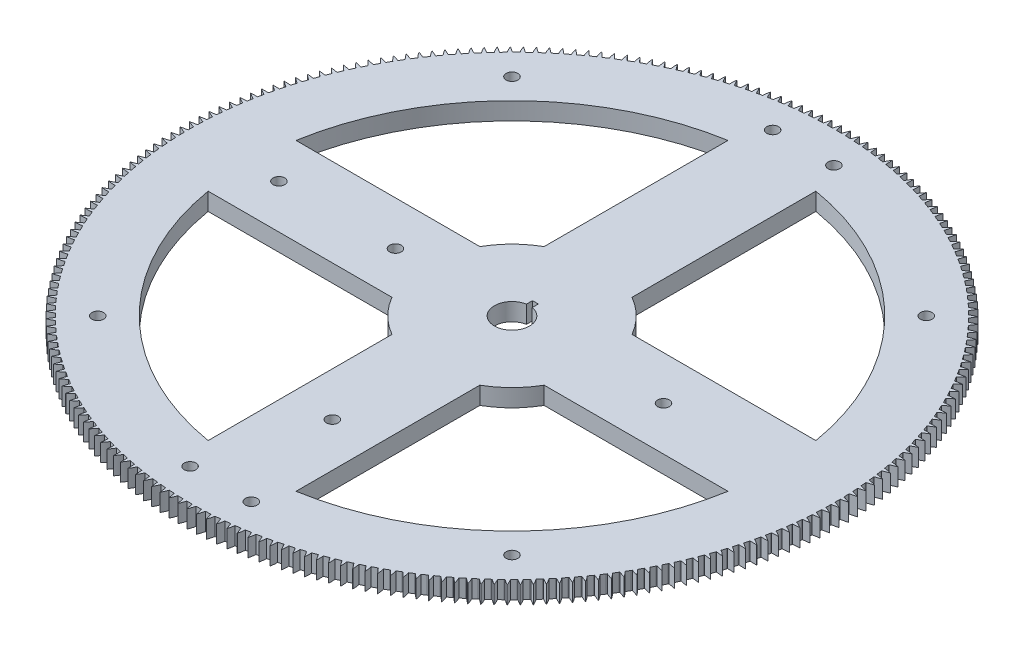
SolidWorks part; units mm, degrees
ref_plane "Front Plane" through (0, 0, 0) normal (0, 0, 1) x (1, 0, 0)
ref_plane "Top Plane" through (0, 0, 0) normal (0, 1, 0) x (1, 0, 0)
ref_plane "Right Plane" through (0, 0, 0) normal (1, 0, 0) x (0, 0, -1)
sketch "Sketch1" plane through (0, 0, 0) normal (0, 1, 0) x (1, 0, 0)
  line L0 (0, 0) -> (0, 53.9742) construction
  line L1 (0, 0) -> (-53.9742, 0) construction
  line L2 (0, 0) -> (-56.2486, -0.3962) construction
  line L3 (0, 0) -> (-53.9689, -0.7604) construction
  line L4 (0, 0) -> (-53.9528, -1.5206) construction
  circle A0 centre (0, 0) radius 55.75 construction
  circle A1 centre (0, 0) radius 53.9742 construction
  circle A2 centre (0, 0) radius 55.125 construction
  circle A3 centre (0, 0) radius 56.25 construction
  spline S0 degree 4 poles (-53.9742, 0) (-54.0235, 0) (-54.1219, -0.0023) (-54.3976, -0.0205) (-54.9164, -0.0854) (-55.7069, -0.2377) (-56.7591, -0.5226) (-58.0929, -0.9847) (-59.6238, -1.6441) (-61.2555, -2.4881) (-62.9679, -3.5289) (-64.6144, -4.674) (-66.194, -5.9096) (-67.7073, -7.2254) (-69.4639, -8.9091) (-71.4602, -11.0612) (-73.6203, -13.7358) (-75.8559, -16.9794) (-77.8889, -20.4383) (-79.6835, -24.0266) (-81.0503, -27.2594) (-82.0803, -30.0856) (-82.8461, -32.4712) (-83.4039, -34.3977) (-83.9076, -36.3363) (-84.3581, -38.293) (-84.7557, -40.2525) (-85.1017, -42.236) (-85.3959, -44.2044) (-85.6406, -46.2185) (-85.8338, -48.1714) (-85.9626, -49.9919) (-86.0385, -51.3811) (-86.0868, -52.7653) (-86.1051, -53.4887) (-86.1211, -54.4894) (-86.1238, -55.2624) (-86.1208, -56.1276) (-86.1084, -56.94) (-86.0889, -57.7851) (-86.0609, -58.6072) (-86.0344, -59.2385) (-86.0139, -59.6496) (-86.0031, -59.8592) knots 0 0 0 0 0 0.002688 0.005377 0.015084 0.028532 0.04661 0.064855 0.092111 0.119476 0.146842 0.174209 0.201575 0.228941 0.256307 0.307035 0.361767 0.4165 0.471232 0.525964 0.580697 0.608063 0.635429 0.662795 0.690161 0.717528 0.744894 0.77226 0.799626 0.826992 0.854358 0.881725 0.895408 0.909091 0.920455 0.931818 0.943182 0.954545 0.965909 0.977273 0.988636 1 1 1 1 1 construction
  spline S1 degree 4 poles (-53.9742, 0) (-54.0235, 0) (-54.1219, -0.0023) (-54.3976, -0.0205) (-54.9164, -0.0854) (-55.7069, -0.2377) (-56.7591, -0.5226) (-58.0929, -0.9847) (-59.6238, -1.6441) (-61.2555, -2.4881) (-62.9679, -3.5289) (-64.6144, -4.674) (-66.194, -5.9096) (-67.7073, -7.2254) (-69.4639, -8.9091) (-71.4602, -11.0612) (-73.6203, -13.7358) (-75.8559, -16.9794) (-77.8889, -20.4383) (-79.6835, -24.0266) (-81.0503, -27.2594) (-82.0803, -30.0856) (-82.8461, -32.4712) (-83.4039, -34.3977) (-83.9076, -36.3363) (-84.3581, -38.293) (-84.7557, -40.2525) (-85.1017, -42.236) (-85.3959, -44.2044) (-85.6406, -46.2185) (-85.8338, -48.1714) (-85.9626, -49.9919) (-86.0385, -51.3811) (-86.0785, -52.5273) (-86.0914, -52.9747) (-86.097, -53.2024) knots 0 0 0 0 0 0.002688 0.005377 0.015084 0.028532 0.04661 0.064855 0.092111 0.119476 0.146842 0.174209 0.201575 0.228941 0.256307 0.307035 0.361767 0.4165 0.471232 0.525964 0.580697 0.608063 0.635429 0.662795 0.690161 0.717528 0.744894 0.77226 0.799626 0.826992 0.854358 0.881725 0.895408 0.909091 0.909091 0.909091 0.909091 0.909091
  dimension "D1" = 112.5
  dimension "D2" = 111.5
  dimension "D3" = 107.9485
  dimension "D4" = 110.25
  dimension "D5" = 53.9742
  dimension "D6" = 0.404
  dimension "D7" = 0.807
  dimension "D8" = 1.614
sketch "Sketch2" plane through (0, 0, 0) normal (0, 1, 0) x (1, 0, 0)
  line L0 (0, 0) -> (-56.2486, -0.3962) construction
  line L1 (0, 0) -> (-56.2486, -0.3962) construction
  line L2 (0, 0) -> (-53.9689, -0.7604) construction
  line L3 (0, 0) -> (-53.9742, 0) construction
  line L4 (0, 0) -> (-53.9528, -1.5206) construction
  line L5 (0, 0) -> (-53.9689, -0.7604) construction
  line L6 (0, 0) -> (-53.9742, 0) construction
  line L7 (0, 0) -> (-53.9528, -1.5206) construction
  line L8 (-55.125, 0) -> (-55.1195, -0.7766) construction
  line L9 (-55.1195, -0.7766) -> (-55.1031, -1.553)
  line L10 (-55.1031, -1.553) -> (-53.9528, -1.5206) construction
  line L11 (-55.1031, -1.553) -> (-2.9988, -0.0845)
  line L12 (-53.9742, 0) -> (-3, 0)
  line L13 (-53.9742, 0) -> (-55.125, 0)
  line L14 (-55.125, 0) -> (-55.1241, -0.1312)
  circle A0 centre (0, 0) radius 55.125 construction
  circle A1 centre (0, 0) radius 53.9742 construction
  circle A2 centre (0, 0) radius 55.75 construction
  circle A3 centre (0, 0) radius 56.25 construction
  circle A4 centre (0, 0) radius 55.125 construction
  circle A5 centre (0, 0) radius 53.9742 construction
  circle A6 centre (0, 0) radius 55.75 construction
  circle A7 centre (0, 0) radius 56.25 construction
  arc A8 (-56.2486, -0.4004) -> (-56.2486, -0.392) centre (0, 0) cw
  circle A11 centre (0, 0) radius 3 construction
  arc A12 (-3, 0) -> (-2.9988, -0.0845) centre (-0.0002, 0) ccw
  spline S0 degree 4 poles (7.0666, 1998.4473) (-46.4874, -61.228) (-48.3447, -1.3043) (-51.6015, 0.3295) (-54.9164, -0.0854) (-55.7069, -0.2377) (-56.7591, -0.5226) (-58.0929, -0.9847) (-59.6238, -1.6441) (-61.2555, -2.4881) (-62.9679, -3.5289) (-64.6144, -4.674) (-66.194, -5.9096) (-67.7073, -7.2254) (-69.4639, -8.9091) (-71.4602, -11.0612) (-73.6203, -13.7358) (-75.8559, -16.9794) (-77.8889, -20.4383) (-79.6835, -24.0266) (-81.0503, -27.2594) (-82.0803, -30.0856) (-82.8461, -32.4712) (-83.4039, -34.3977) (-83.9076, -36.3363) (-84.3581, -38.293) (-84.7557, -40.2525) (-85.1017, -42.236) (-85.3959, -44.2044) (-85.6406, -46.2185) (-85.8338, -48.1714) (-85.9626, -49.9919) (-86.2032, -54.3966) (-86.2268, -62.3247) (-84.2314, 4.188) (-134.1673, -2052.2405) knots -0.153792 -0.153792 -0.153792 -0.153792 -0.153792 0.002688 0.005377 0.015084 0.028532 0.04661 0.064855 0.092111 0.119476 0.146842 0.174209 0.201575 0.228941 0.256307 0.307035 0.361767 0.4165 0.471232 0.525964 0.580697 0.608063 0.635429 0.662795 0.690161 0.717528 0.744894 0.77226 0.799626 0.826992 0.854358 0.881725 0.895408 1.087301 1.087301 1.087301 1.087301 1.087301 only from (-53.9742, 0) to (-86.097, -53.2024) construction
  spline S1 degree 4 poles (-55.1241, -0.1312) (-55.353, -0.1735) (-55.6354, -0.2338) (-55.916, -0.302) (-56.1947, -0.3772) (-56.2486, -0.392) knots 0.015819 0.015819 0.015819 0.015819 0.015819 0.028532 0.031584 0.031584 0.031584 0.031584 0.031584
  spline S2 degree 4 poles (-55.1195, -0.7766) (-55.1271, -0.7751) (-55.2126, -0.7585) (-55.4041, -0.712) (-55.6895, -0.6254) (-55.9614, -0.523) (-56.156, -0.4412) (-56.2486, -0.4004) knots 0.004428 0.004428 0.004428 0.004428 0.004428 0.005377 0.015084 0.028532 0.040915 0.040915 0.040915 0.040915 0.040915
  point P18 (-55.1223, -0.3883)
  point P24 (-55.1031, -1.553)
  dimension "D2" = 6
extrude "Boss-Extrude1" add sketch "Sketch2" along normal blind 3
pattern_circular "CirPattern1" count 223 over 360 of "Boss-Extrude1"
sketch "Sketch3" plane through (0, 3, 0) normal (0, 1, 0) x (1, 0, 0)
  line L1 (0.5, 1.9998) -> (-0.5, 1.9998)
  line L2 (0.5, 1.9998) -> (0.5, 3.9998)
  line L3 (0.5, 3.9998) -> (-0.5, 3.9998)
  line L4 (-0.5, 1.9998) -> (-0.5, 3.9998)
  line L5 (0.5, 1.9998) -> (-0.5, 3.9998) construction
  line L6 (0.5, 3.9998) -> (-0.5, 1.9998) construction
  circle A0 centre (-0.0001, -0.0001) radius 2.9999 construction
  point P0 (0, 2.9998)
  dimension "D1" = 2
  dimension "D2" = 1
extrude "Cut-Extrude1" cut sketch "Sketch3" against normal up to surface (3 mm away)
sketch "Sketch4" plane through (0, 3, 0) normal (0, 1, 0) x (1, 0, 0)
  line L0 (-44.3707, 7.5) -> (-12.9905, 7.5)
  line L1 (-44.3707, -7.5) -> (-12.9905, -7.5)
  line L2 (-7.5002, -44.3706) -> (-7.5002, -12.9904)
  line L3 (7.4998, -44.3706) -> (7.4998, -12.9904)
  line L4 (44.3704, -7.5) -> (12.9902, -7.5)
  line L5 (44.3704, 7.5) -> (12.9902, 7.5)
  line L6 (7.4998, 44.3706) -> (7.4998, 12.9904)
  line L7 (-7.5002, 44.3706) -> (-7.5002, 12.9904)
  arc A0 (-12.9905, -7.5) -> (-7.5002, -12.9904) centre (-0.0002, 0) ccw
  arc A1 (-44.3707, -7.5) -> (-7.5002, -44.3706) centre (-0.0002, 0) ccw
  arc A2 (7.4998, -44.3706) -> (44.3704, -7.5) centre (-0.0002, 0) ccw
  arc A3 (7.4998, -12.9904) -> (12.9902, -7.5) centre (-0.0002, 0) ccw
  arc A4 (-7.5002, 12.9904) -> (-12.9905, 7.5) centre (-0.0002, 0) ccw
  arc A5 (-7.5002, 44.3706) -> (-44.3707, 7.5) centre (-0.0002, 0) ccw
  arc A6 (12.9902, 7.5) -> (7.4998, 12.9904) centre (-0.0002, 0) ccw
  arc A7 (44.3704, 7.5) -> (7.4998, 44.3706) centre (-0.0002, 0) ccw
  dimension "D1" = 45
  dimension "D2" = 15
  dimension "D3" = 15
extrude "Cut-Extrude2" cut sketch "Sketch4" against normal up to surface (3 mm away)
sketch "Sketch5" plane through (0, 3, 0) normal (0, 1, 0) x (1, 0, 0)
  circle A0 centre (0, 0) radius 9.9472
  circle A1 centre (0, 0) radius 23.2764
  circle A2 centre (25.8627, 0) radius 15.9155
  circle A3 centre (-19.8944, 0) radius 9.9472
  circle A4 centre (0, -30.6622) radius 7.3858
  circle A5 centre (-39.7887, 0) radius 9.9472
  dimension "D1" = 19.8944
  dimension "D2" = 19.8944
  dimension "D3" = 19.8944
  dimension "D4" = 31.831
  dimension "D5" = 46.5528
  dimension "D6" = 14.7716
sketch "Sketch6" plane through (0, 3, 0) normal (0, 1, 0) x (1, 0, 0)
  line L0 (-5.2264, 49.7261) -> (5.2264, -49.7261) construction
  line L1 (5.2264, 49.7261) -> (-5.2264, -49.7261) construction
  line L2 (7.4998, 44.3706) -> (7.4998, 12.9904) construction
  line L3 (-35.3553, 35.3553) -> (35.3553, -35.3553) construction
  line L4 (-35.3553, -35.3553) -> (35.3553, 35.3553) construction
  line L5 (-5.2264, 49.7261) -> (5.2264, 49.7261) construction
  circle A0 centre (-39.7887, 0) radius 1
  circle A1 centre (-19.8944, 0) radius 1
  circle A2 centre (0, -30.6622) radius 1
  circle A3 centre (25.8627, 0) radius 1
  circle A4 centre (-5.2264, 49.7261) radius 1
  circle A5 centre (5.2264, 49.7261) radius 1
  circle A6 centre (-5.2264, -49.7261) radius 1
  circle A7 centre (5.2264, -49.7261) radius 1
  circle A8 centre (-35.3553, 35.3553) radius 1
  circle A9 centre (-35.3553, -35.3553) radius 1
  circle A10 centre (35.3553, -35.3553) radius 1
  circle A11 centre (35.3553, 35.3553) radius 1
  point P20 (0, 0)
  point P32 (0, 49.7261)
  dimension "D1" = 2
  dimension "D2" = 45
  dimension "D3" = 12
  dimension "D5" = 100
extrude "Cut-Extrude3" cut sketch "Sketch6" against normal blind 3
equation "\"Module\"= .5"
equation "\"Number of Teeth\"= 223"
equation "\"Pressure Angle\"= 14.5deg"
equation "\"Pitch Diameter\"= \"Number of Teeth\" * \"Module\""
equation "\"Circular Pitch\"= pi * \"Module\""
equation "\"Addendum\"= \"Module\""
equation "\"Dedendum\"= 1.25 * \"Module\""
equation "\"Base Diameter\"= \"Pitch Diameter\" * cos ( \"Pressure Angle\" )"
equation "\"Base Radius\"= \"Base Diameter\" / 2"
equation "\"Width\"= 3mm"
equation "\"Outside Diameter\"= \"Pitch Diameter\" + 2 * \"Addendum\""
equation "\"D1@Sketch1\"=\"Outside Diameter\""
equation "\"D3@Sketch1\"=\"Base Diameter\""
equation "\"Root Diameter\"= \"Pitch Diameter\" - 2 * \"Dedendum\""
equation "\"D4@Sketch1\"=\"Root Diameter\""
equation "\"Tooth Angle\"= 360 / \"Number of Teeth\""
equation "\"D6@Sketch1\"=\"Tooth Angle\"/4"
equation "\"D7@Sketch1\"=\"Tooth Angle\"/2"
equation "\"D8@Sketch1\"=\"Tooth Angle\""
equation "\"D2@Sketch1\" = \"Pitch Diameter\""
equation "\"Shaft Diameter\"= 6"
equation "\"D1@CirPattern1\" = \"Number of Teeth\""
equation "\"D2@Sketch2\"  = \"Shaft Diameter\""
equation "\"D1@Boss-Extrude1\" = \"Width\""
equation "\"scale\"= 1.5625"
equation "\"mercury1\"= 104"
equation "\"mercury2\"= 33"
equation "\"venus1\"= 64"
equation "\"sun1\"= 40"
equation "\"sun2\"= 40"
equation "\"sun3\"= 40"
equation "\"D1@Sketch5\"=\"sun1\"/pi*\"scale\""
equation "\"D2@Sketch5\"=\"sun1\"/pi*\"scale\""
equation "\"D3@Sketch5\"=\"sun1\"/pi*\"scale\""
equation "\"D4@Sketch5\"=\"venus1\"/pi*\"scale\""
equation "\"D5@Sketch5\"=\"mercury1\"/pi*\"scale\"*.9"
equation "\"D6@Sketch5\"=\"mercury2\"/pi*\"scale\"*.9"
